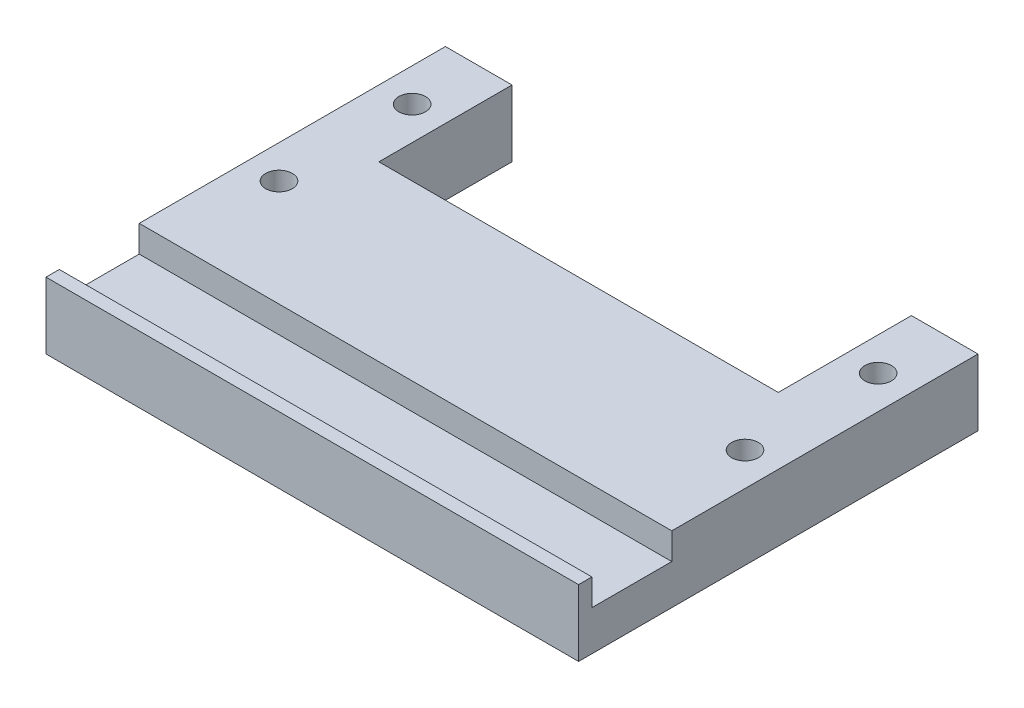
SolidWorks part; units mm, degrees
ref_plane "Front Plane" through (0, 0, 0) normal (0, 0, 1) x (1, 0, 0)
ref_plane "Top Plane" through (0, 0, 0) normal (0, 1, 0) x (1, 0, 0)
ref_plane "Right Plane" through (0, 0, 0) normal (1, 0, 0) x (0, 0, -1)
sketch "Sketch1" plane through (0, 0, 0) normal (0, 1, 0) x (1, 0, 0)
  line L1 (-25.4, 12.7) -> (25.4, 12.7)
  line L2 (-25.4, 12.7) -> (-25.4, -12.7)
  line L3 (-25.4, -12.7) -> (25.4, -12.7)
  line L4 (25.4, 12.7) -> (25.4, -12.7)
  line L5 (-25.4, 12.7) -> (25.4, -12.7) construction
  line L6 (-25.4, -12.7) -> (25.4, 12.7) construction
  point P0 (0, 0)
  dimension "D1" = 50.8
  dimension "D2" = 25.4
extrude "Boss-Extrude1" add sketch "Sketch1" along normal blind 6.35
sketch "Sketch2" plane through (0, 6.35, 0) normal (0, 1, 0) x (1, 0, 0)
  line L0 (-25.4, -12.7) -> (25.4, -12.7) construction
  line L1 (-27.3245, -3.81) -> (27.3245, -3.81)
  line L2 (-27.3245, -3.81) -> (-27.3245, -11.43)
  line L3 (-27.3245, -11.43) -> (27.3245, -11.43)
  line L4 (27.3245, -3.81) -> (27.3245, -11.43)
  line L5 (-27.3245, -3.81) -> (27.3245, -11.43) construction
  line L6 (-27.3245, -11.43) -> (27.3245, -3.81) construction
  point P0 (0, -7.62)
  dimension "D1" = 7.62
  dimension "D2" = 7.62
  dimension "D3" = 1.27
sketch "Sketch3" plane through (0, 0, -12.7) normal (0, 0, -1) x (-1, 0, 0)
  line L0 (-25.4, 0) -> (25.4, 0) construction
  line L1 (-25.4, 6.35) -> (-19.05, 6.35)
  line L2 (-25.4, 6.35) -> (-25.4, 0)
  line L3 (-25.4, 0) -> (-19.05, 0)
  line L4 (-19.05, 6.35) -> (-19.05, 0)
  line L5 (0, 0) -> (0, 9.9076) construction
  line L6 (25.4, 0) -> (19.05, 0)
  line L7 (19.05, 6.35) -> (19.05, 0)
  line L8 (25.4, 6.35) -> (19.05, 6.35)
  line L9 (25.4, 6.35) -> (25.4, 0)
  dimension "D1" = 6.35
extrude "Boss-Extrude2" add sketch "Sketch3" along normal blind 12.7
sketch "Sketch5" plane through (0, 6.35, 0) normal (0, 1, 0) x (1, 0, 0)
  line L0 (-22.225, 20.32) -> (-22.225, 5.08) construction
  line L1 (-25.4, 25.4) -> (-19.05, 25.4) construction
  line L3 (0, 0) -> (0, 25.4) construction
  line L5 (-25.4, 25.4) -> (-25.4, -12.7) construction
  circle A0 centre (-22.225, 6.35) radius 1.27
  circle A1 centre (-22.225, 19.05) radius 1.27
  circle A2 centre (22.225, 6.35) radius 1.27
  circle A3 centre (22.225, 19.05) radius 1.27
  dimension "D1" = 2.54
  dimension "D2" = 2.54
  dimension "D3" = 12.7
  dimension "D4" = 6.35
  dimension "D5" = 3.175
extrude "Cut-Extrude3" cut sketch "Sketch5" against normal through all
extrude "Cut-Extrude4" cut sketch "Sketch2" against normal blind 2.54
sketch "Sketch7" plane through (0, 0, 0) normal (0, -1, 0) x (1, 0, 0)
  line L0 (19.05, -12.7) -> (-19.05, -12.7) construction
  line L1 (-20.32, 2.54) -> (20.32, 2.54)
  line L2 (-20.32, 2.54) -> (-20.32, -11.43)
  line L3 (-20.32, -11.43) -> (20.32, -11.43)
  line L4 (20.32, 2.54) -> (20.32, -11.43)
  line L5 (-19.05, -25.4) -> (-19.05, -12.7) construction
  line L6 (19.05, -25.4) -> (19.05, -12.7) construction
  line L7 (-25.4, 12.7) -> (25.4, 12.7) construction
  dimension "D1" = 1.27
  dimension "D2" = 1.27
  dimension "D3" = 1.27
  dimension "D4" = 10.16
extrude "Cut-Extrude5" cut sketch "Sketch7" against normal offset from surface (5.08 mm away) 1.27
